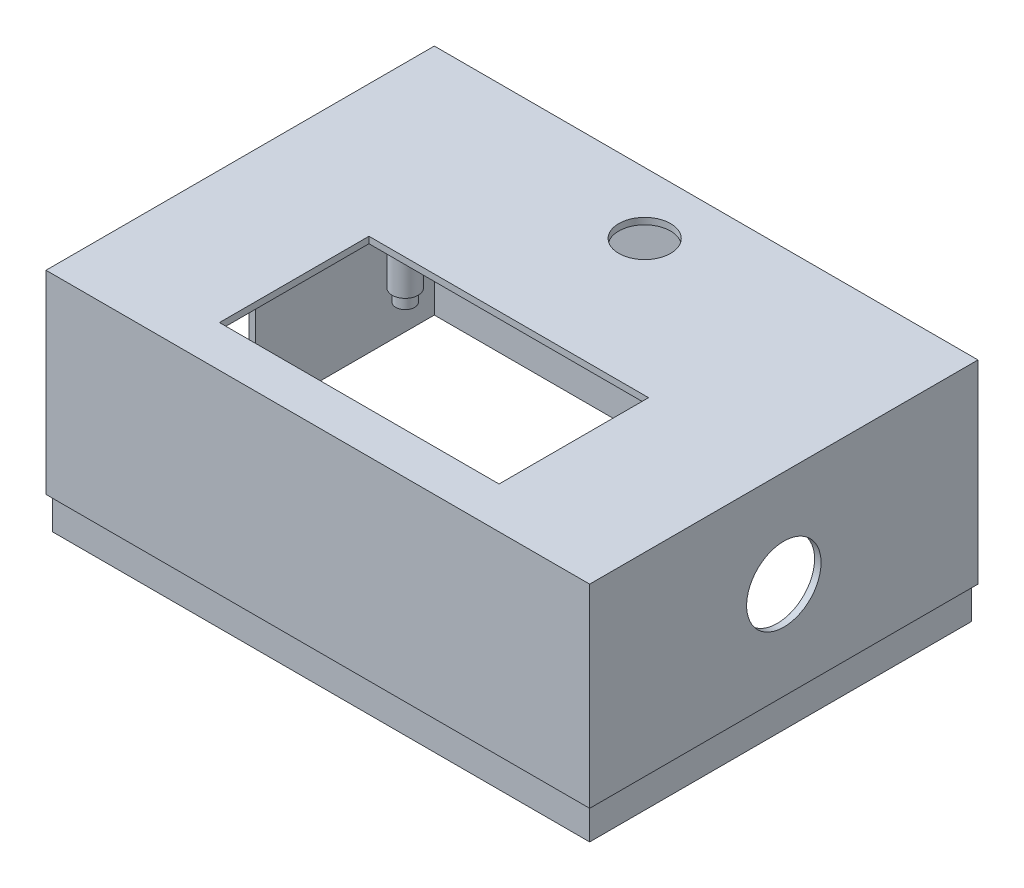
SolidWorks part; units mm, degrees
ref_plane "Front Plane" through (0, 0, 0) normal (0, 0, 1) x (1, 0, 0)
ref_plane "Top Plane" through (0, 0, 0) normal (0, 1, 0) x (1, 0, 0)
ref_plane "Right Plane" through (0, 0, 0) normal (1, 0, 0) x (0, 0, -1)
sketch "Sketch27" plane through (0, 0, 0) normal (0, 1, 0) x (1, 0, 0)
  line L1 (0, 0) -> (84, 0)
  line L2 (0, 0) -> (0, 60)
  line L3 (0, 60) -> (84, 60)
  line L4 (84, 0) -> (84, 60)
  dimension "D1" = 60
  dimension "D2" = 84
extrude "Boss-Extrude1" add sketch "Sketch27" along normal blind 30 contours L2 L1 L4 L3
sketch "Sketch28" plane through (0, 0, 0) normal (0, -1, 0) x (1, 0, 0)
  line L1 (0.5, -59.5) -> (83.5, -59.5)
  line L2 (0.5, -59.5) -> (0.5, -0.5)
  line L3 (0.5, -0.5) -> (83.5, -0.5)
  line L4 (83.5, -59.5) -> (83.5, -0.5)
  dimension "D1" = 59
  dimension "D2" = 83
extrude "Boss-Extrude2" add sketch "Sketch28" along normal blind 5
sketch "Sketch29" plane through (0, -5, 0) normal (0, -1, 0) x (1, 0, 0)
  line L1 (1, -59) -> (83, -59)
  line L2 (1, -59) -> (1, -1)
  line L3 (1, -1) -> (83, -1)
  line L4 (83, -59) -> (83, -1)
  dimension "D1" = 58
  dimension "D2" = 82
extrude "Cut-Extrude2" cut sketch "Sketch29" against normal blind 34
sketch "Sketch31" plane through (0, 29, 0) normal (0, -1, 0) x (1, 0, 0)
  line L1 (79, -7) -> (2, -7)
  line L2 (79, -7) -> (79, -53.5)
  line L3 (79, -53.5) -> (2, -53.5)
  line L4 (2, -7) -> (2, -53.5)
  dimension "D1" = 46.5
  dimension "D2" = 77
sketch "Sketch32" plane through (0, 29, 0) normal (0, -1, 0) x (1, 0, 0)
  circle A0 centre (6, -11) radius 0.75
  circle A1 centre (6, -49.5) radius 0.75
  circle A2 centre (75, -49.5) radius 0.75
  circle A3 centre (75, -11) radius 0.75
sketch "Sketch36" plane through (0, 30, 0) normal (0, 1, 0) x (1, 0, 0)
  line L1 (71, 34) -> (13, 34)
  line L2 (71, 34) -> (71, 2)
  line L3 (71, 2) -> (13, 2)
  line L4 (13, 34) -> (13, 2)
  dimension "D1" = 32
  dimension "D2" = 58
sketch "Sketch38" plane through (0, 30, 0) normal (0, 1, 0) x (1, 0, 0)
  line L1 (63.6, 29.5) -> (20.4, 29.5)
  line L2 (63.6, 29.5) -> (63.6, 6.4)
  line L3 (63.6, 6.4) -> (20.4, 6.4)
  line L4 (20.4, 29.5) -> (20.4, 6.4)
  dimension "D1" = 23.1
  dimension "D2" = 43.2
extrude "Cut-Extrude3" cut sketch "Sketch38" against normal blind 1
sketch "Sketch39" plane through (0, 30, 0) normal (0, 1, 0) x (1, 0, 0)
  line L1 (51.25, 57.5) -> (32.75, 57.5)
  line L2 (51.25, 57.5) -> (51.25, 36)
  line L3 (51.25, 36) -> (32.75, 36)
  line L4 (32.75, 57.5) -> (32.75, 36)
  dimension "D1" = 21.5
  dimension "D2" = 18.5
sketch "Sketch40" plane through (0, 30, 0) normal (0, 1, 0) x (1, 0, 0)
  circle A0 centre (42, 50.5) radius 4
sketch "Sketch42" plane through (0, 30, 0) normal (0, 1, 0) x (1, 0, 0)
  circle A0 centre (47.25, 45.5) radius 0.75
  circle A1 centre (47.25, 55.5) radius 0.75
  circle A2 centre (36.75, 45.5) radius 0.75
  circle A3 centre (36.75, 55.5) radius 0.75
  point P5 (47.25, 55.5)
  point P8 (36.75, 55.5)
  point P9 (47.25, 45.5)
  point P10 (36.75, 45.5)
extrude "Cut-Extrude5" cut sketch "Sketch40" against normal blind 1
sketch "Sketch45" plane through (0, 29, 0) normal (0, -1, 0) x (1, 0, 0)
  circle A0 centre (15.5, -4.5) radius 1.25
  circle A1 centre (15.5, -31.5) radius 1.25
  circle A2 centre (68.5, -31.5) radius 1.25
  circle A3 centre (68.5, -4.5) radius 1.25
  point P0 (15.5, -4.5)
sketch "Sketch46" plane through (0, 29, 0) normal (0, -1, 0) x (1, 0, 0)
  circle A0 centre (6, -49.5) radius 2
  circle A1 centre (6, -11) radius 2
  circle A2 centre (75, -11) radius 2
  circle A3 centre (75, -49.5) radius 2
extrude "Boss-Extrude3" add sketch "Sketch46" along normal blind 23.1
sketch "Sketch47" plane through (0, 5.9, 0) normal (0, -1, 0) x (1, 0, 0)
  point P0 (6, -11)
  point P1 (6, -49.5)
  point P3 (75, -49.5)
  point P5 (75, -11)
sketch "Sketch48" plane through (0, 5.9, 0) normal (0, -1, 0) x (1, 0, 0)
  circle A0 centre (6, -11) radius 1.45
  circle A1 centre (6, -49.5) radius 1.45
  circle A2 centre (75, -49.5) radius 1.45
  circle A3 centre (75, -11) radius 1.45
extrude "Boss-Extrude4" add sketch "Sketch48" along normal blind 1.9
sketch "Sketch49" plane through (0, 4, 0) normal (0, -1, 0) x (1, 0, 0)
  point P0 (75, -11)
  point P1 (6, -11)
  point P3 (6, -49.5)
  point P5 (75, -49.5)
hole_wizard "#4-40 Tapped Hole2" positions "3DSketch6" profile "Sketch54" tap size "#4-40" standard "ANSI Inch"
sketch3d "3DSketch6"
  line L0 (6, 4, -11) -> (6, 5.9, -11) construction
  line L1 (6, 4, -49.5) -> (6, 5.9, -49.5) construction
  line L2 (6, 5.9, -49.5) -> (6, 29, -49.5) construction
  point P0 (6, 4.7351, -11)
  point P4 (6, 3.7809, -11)
  point P6 (6, 3.7809, -11)
  point P8 (6, 4, -11)
  point P14 (6, 4.3485, -49.5)
  point P20 (6, 4, -49.5)
  point P24 (75, 4, -49.5)
  point P28 (75, 4, -11)
sketch "Sketch54" plane through (75, 4, -11) normal (1, 0, 0) x (0, 0, -1)
  line L0 (0, 0) -> (0, 7.0292)
  line L1 (0, 7.0292) -> (1.1303, 6.35)
  line L2 (1.1303, 6.35) -> (1.1303, 0)
  line L5 (1.1303, 0) -> (0, 0)
  line L10 (0, 7.0292) -> (-1.1303, 6.35) construction
  line L11 (0, -6.35) -> (0, 107.95) construction
  dimension "Tap Drill Dia." = 2.2606
  dimension "Tap Drill Depth" = 6.35
  dimension "Drill Angle" = 118
sketch "Sketch57" plane through (0, 0, 0) normal (-1, 0, 0) x (0, 0, 1)
  line L2 (-31.4, 1.9) -> (-18.4, 1.9)
  line L3 (-31.4, 1.9) -> (-31.4, 9.9)
  line L4 (-31.4, 9.9) -> (-18.4, 9.9)
  line L5 (-18.4, 1.9) -> (-18.4, 9.9)
  point P0 (-18.4, 9.9)
  point P2 (-31.4, 1.9)
  point P3 (-53.5, 22.7954)
extrude "Cut-Extrude6" cut sketch "Sketch57" against normal blind 1
sketch "Sketch58" plane through (84, 0, 0) normal (1, 0, 0) x (0, 0, -1)
  circle A0 centre (30, 15) radius 5.75
  point P0 (30, 15)
extrude "Cut-Extrude7" cut sketch "Sketch58" against normal blind 1
